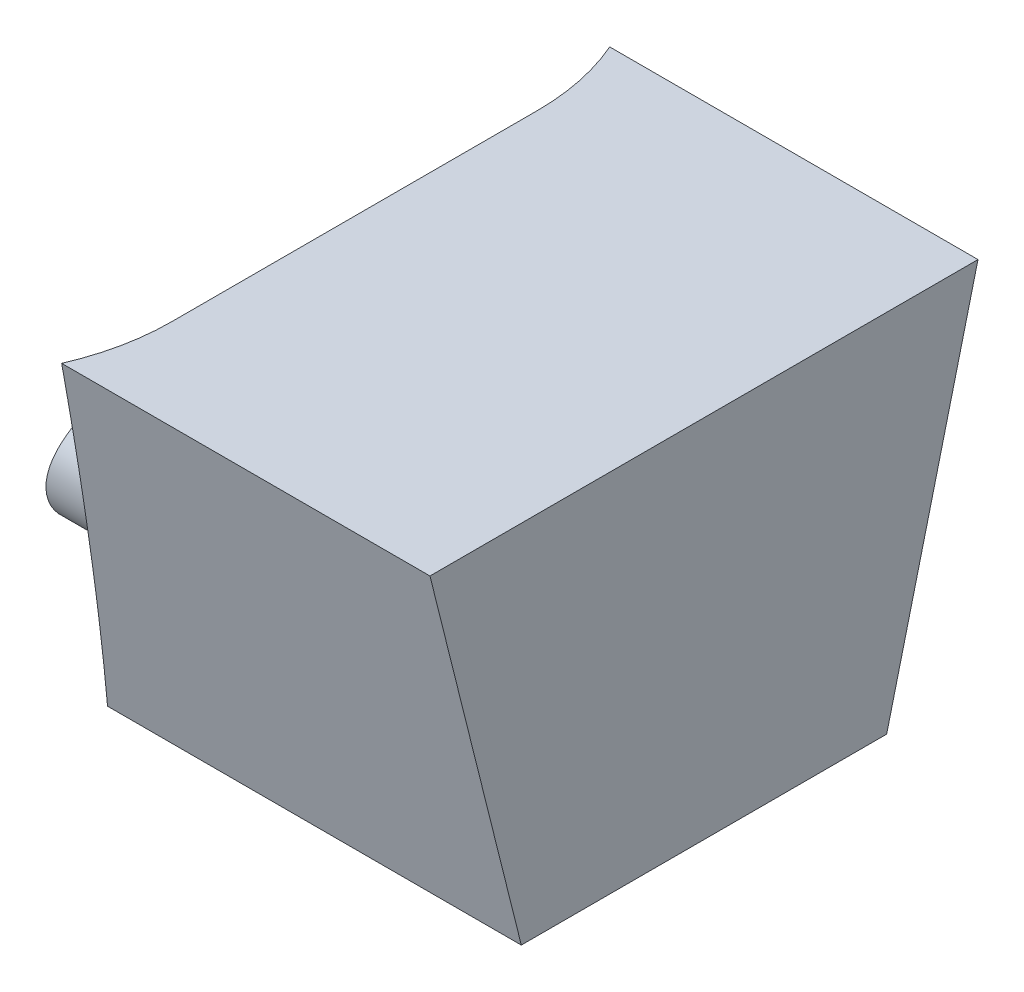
SolidWorks part; units mm, degrees
ref_plane "Front Plane" through (0, 0, 0) normal (0, 0, 1) x (1, 0, 0)
ref_plane "Top Plane" through (0, 0, 0) normal (0, 1, 0) x (1, 0, 0)
ref_plane "Right Plane" through (0, 0, 0) normal (1, 0, 0) x (0, 0, -1)
body saved out of another part "Stock-Part1-1"
